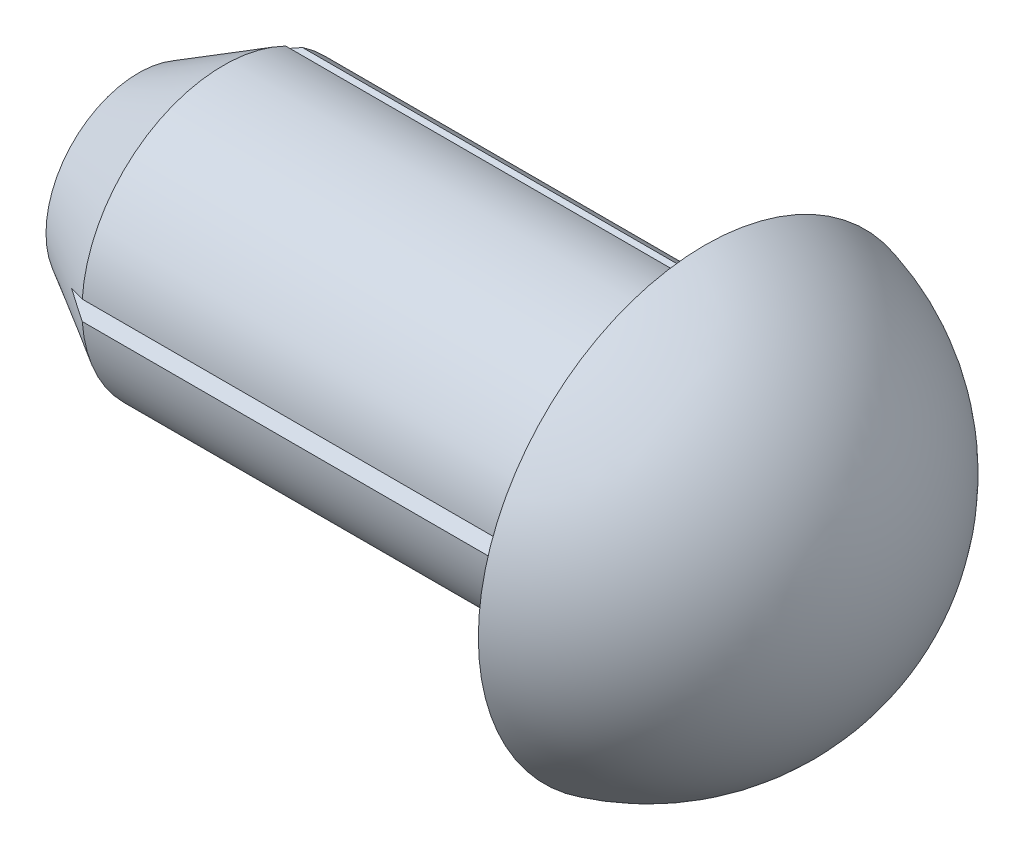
SolidWorks part; units mm, degrees
ref_plane "Plane1" through (0, 0, 0) normal (0, 0, 1) x (1, 0, 0)
ref_plane "Plane2" through (0, 0, 0) normal (0, 1, 0) x (1, 0, 0)
ref_plane "Plane3" through (0, 0, 0) normal (1, 0, 0) x (0, 0, -1)
sketch "Sketch1" plane through (0, 0, 0) normal (0, 0, 1) x (1, 0, 0)
  line L0 (-40, 0) -> (40, 0) construction
  line L1 (-40, 0) -> (-40, 6.5359)
  line L2 (-34, 10) -> (0, 10)
  line L3 (0, 10) -> (0, 16)
  line L6 (12.4689, 0) -> (-40, 0)
  line L7 (-40, 6.5359) -> (-34, 10)
  arc A0 (12.4689, 0) -> (0, 16) centre (-4.0311, 0) ccw
  dimension "D1" = 30
  dimension "HeadRadius" = 16.5
  dimension "HeadDia" = 32
  dimension "Diameter" = 20
  dimension "Length" = 40
  dimension "ChamferLength" = 6
revolve "Base-Revolve" add sketch "Sketch1" angle 360 about L0
sketch "Sketch2" plane through (-40, 0, 0) normal (-1, 0, 0) x (0, 0, 1)
  line L0 (0, 0) -> (12, 0) construction
  line L1 (9, 0) -> (10, 0.7002)
  line L2 (9, 0) -> (10, -0.7002)
  line L3 (10, -0.7002) -> (10, 0.7002)
  circle A0 centre (0, 0) radius 9 construction
  circle A1 centre (0, 0) radius 10 construction
  dimension "D1" = 18
  dimension "D2" = 70
  dimension "D3" = 35
extrude "Cut-Extrude1" cut sketch "Sketch2" against normal blind 37
pattern_circular "CirPattern1" count 3 over 360 about axis through (0, 0, 0) along (1, 0, 0) of "Cut-Extrude1"
equation "\"D1@Sketch2\" = \"Diameter@Sketch1\" * .9"
equation "\"D3@Sketch2\" = \"D2@Sketch2\" / 2"
equation "\"D1@Cut-Extrude1\" = \"Length@Sketch1\" - \"ChamferLength@Sketch1\" / 2"
